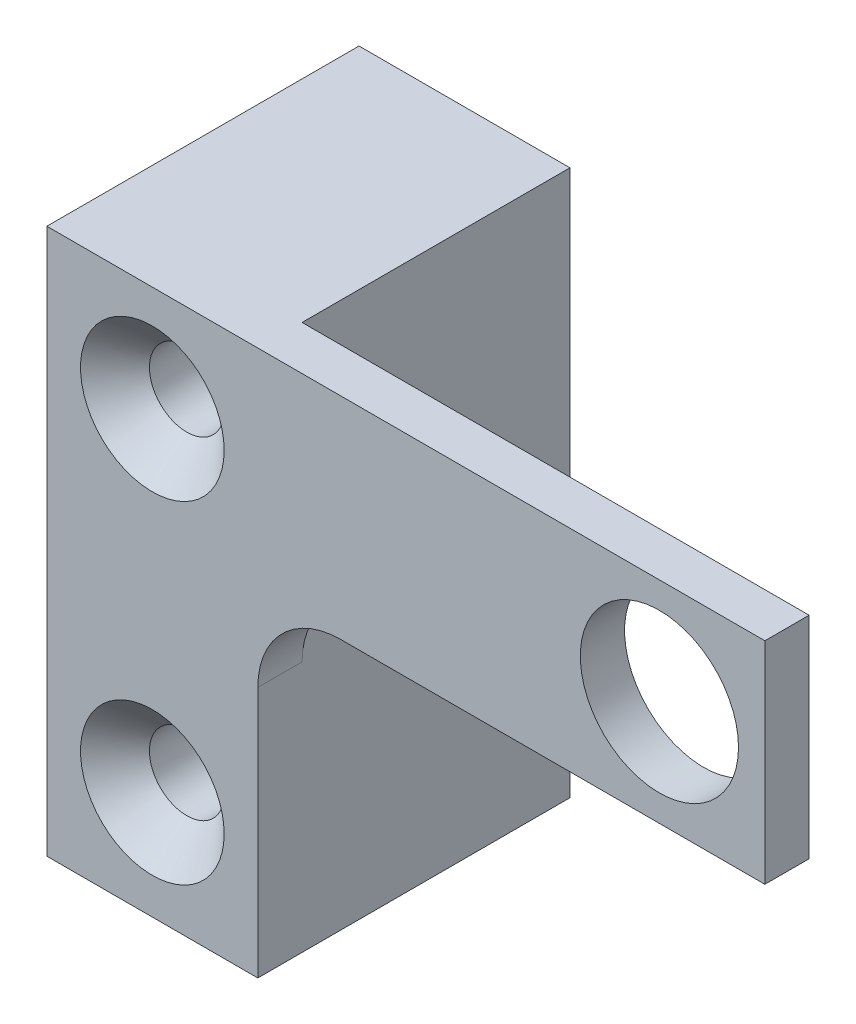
SolidWorks part; units mm, degrees
ref_plane "Front Plane" through (0, 0, 0) normal (0, 0, 1) x (1, 0, 0)
ref_plane "Top Plane" through (0, 0, 0) normal (0, 1, 0) x (1, 0, 0)
ref_plane "Right Plane" through (0, 0, 0) normal (1, 0, 0) x (0, 0, -1)
sketch "Sketch1" plane through (0, 0, 0) normal (0, 0, 1) x (1, 0, 0)
  line L1 (0, 0) -> (25.4, 0)
  line L2 (0, 0) -> (0, -65.7)
  line L3 (0, -65.7) -> (25.4, -65.7)
  line L4 (25.4, 0) -> (25.4, -65.7)
  dimension "D1" = 25.4
  dimension "D2" = 65.7
extrude "Boss-Extrude1" add sketch "Sketch1" along normal blind 32.26
sketch "Sketch2" plane through (0, 0, 32.26) normal (0, 0, 1) x (1, 0, 0)
  line L1 (0, 0) -> (86.46, 0)
  line L2 (0, 0) -> (0, -25.4)
  line L3 (0, -25.4) -> (86.46, -25.4)
  line L4 (86.46, 0) -> (86.46, -25.4)
  dimension "D1" = 25.4
  dimension "D2" = 86.46
extrude "Boss-Extrude2" add sketch "Sketch2" along normal blind 5.33
sketch "Sketch3" plane through (0, 0, 32.26) normal (0, 0, 1) x (1, 0, 0)
  line L1 (0, -25.4) -> (25.4, -25.4)
  line L2 (0, -25.4) -> (0, -65.7)
  line L3 (0, -65.7) -> (25.4, -65.7)
  line L4 (25.4, -25.4) -> (25.4, -65.7)
extrude "Boss-Extrude3" add sketch "Sketch3" along normal up to surface (5.33 mm away)
sketch "Sketch4" plane through (0, 0, 37.59) normal (0, 0, 1) x (1, 0, 0)
  line L0 (86.46, 0) -> (0, 0) construction
  line L2 (86.46, -25.4) -> (86.46, 0) construction
  circle A0 centre (73.76, -12.7) radius 9.525
  dimension "D1" = 19.05
  dimension "D2" = 12.7
  dimension "D3" = 12.7
extrude "Cut-Extrude1" cut sketch "Sketch4" against normal through all
hole_wizard "CSK for M8 Flat Head Machine Screw1" positions "Sketch6" profile "Sketch5" countersink size "M8" standard "Ansi Metric"
sketch "Sketch6" plane through (0, 0, 37.59) normal (0, 0, 1) x (1, 0, 0)
  line L0 (86.46, 0) -> (0, 0) construction
  line L1 (25.4, -65.7) -> (25.4, -25.4) construction
  point P0 (12.7, -12.7)
  point P1 (12.7, -52.7)
  dimension "D1" = 12.7
  dimension "D2" = 40
  dimension "D3" = 12.7
sketch "Sketch5" plane through (12.7, -12.7, 37.59) normal (1, 0, 0) x (0, -1, 0)
  line L0 (0, 0) -> (0, 37.59)
  line L1 (0, 37.59) -> (4.5, 37.59)
  line L2 (4.5, 37.59) -> (4.5, 4.15)
  line L3 (4.5, 4.15) -> (8.65, 0)
  line L5 (8.65, 0) -> (0, 0)
  line L6 (-4.5, 4.15) -> (-8.65, 0) construction
  line L11 (0, -6.35) -> (0, 107.95) construction
  dimension "Thru Hole Dia." = 9
  dimension "Thru Hole Depth" = 37.59
  dimension "Near C'Sink Dia." = 17.3
  dimension "Near C'Sink Angle" = 90
fillet "Fillet1" radius 10 1 edges at (25.4, -25.4, 34.925)
